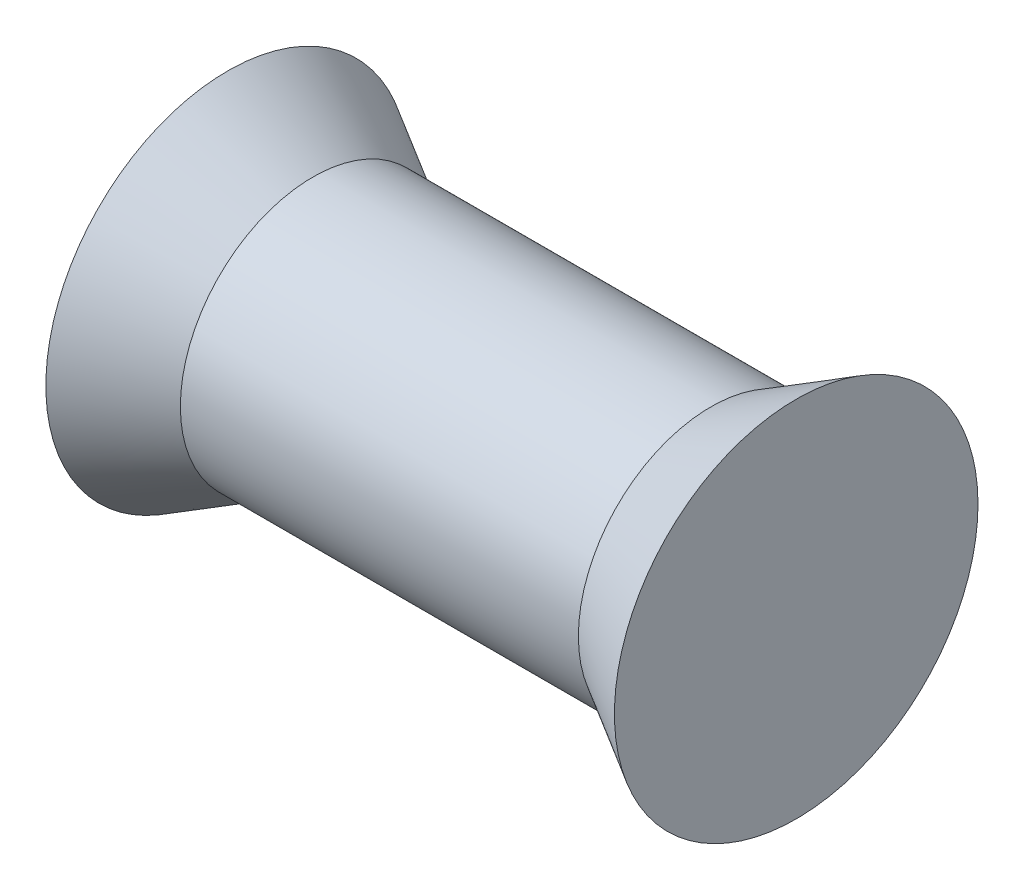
SolidWorks part; units mm, degrees
ref_plane "Спереди" through (0, 0, 0) normal (0, 0, 1) x (1, 0, 0)
ref_plane "Сверху" through (0, 0, 0) normal (0, 1, 0) x (1, 0, 0)
ref_plane "Справа" through (0, 0, 0) normal (1, 0, 0) x (0, 0, -1)
sketch "Эскиз1" plane through (0, 0, 0) normal (0, 0, 1) x (1, 0, 0)
  line L0 (0, 0) -> (-49.4301, 0) construction
  line L1 (0, 0) -> (0, 3.2484)
  line L2 (0, 3.2484) -> (-1.524, 2.3685)
  line L3 (-1.524, 2.3685) -> (-8.636, 2.3685)
  line L4 (-8.636, 2.3685) -> (-10.16, 3.2484)
  line L5 (-10.16, 3.2484) -> (-10.16, 0)
  line L6 (-10.16, 0) -> (0, 0)
  dimension "D1" = 30
  dimension "D2" = 30
  dimension "D3" = 4.7371
  dimension "D4" = 1.524
  dimension "D5" = 7.112
revolve "Повернуть1" add sketch "Эскиз1" angle 360 about L0
